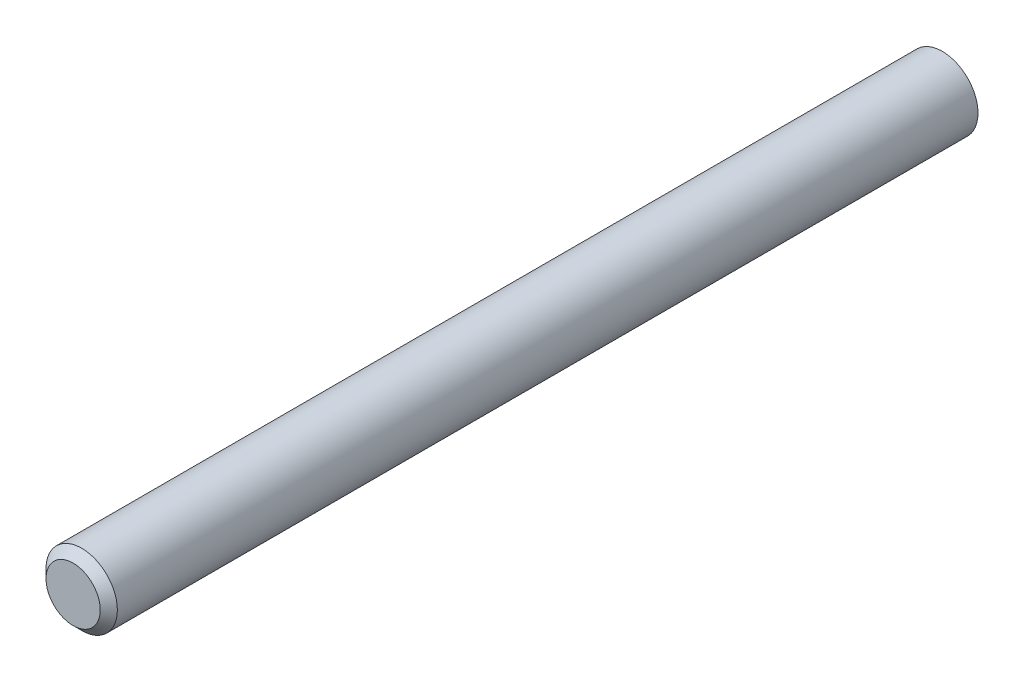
SolidWorks part; units mm, degrees
ref_plane "Front Plane" through (0, 0, 0) normal (0, 0, 1) x (1, 0, 0)
ref_plane "Top Plane" through (0, 0, 0) normal (0, 1, 0) x (1, 0, 0)
ref_plane "Right Plane" through (0, 0, 0) normal (1, 0, 0) x (0, 0, -1)
sketch "Sketch1" plane through (0, 0, 0) normal (0, 0, 1) x (1, 0, 0)
  circle A1 centre (0, 0) radius 3.175
  circle A2 centre (0, 0) radius 3.175
  dimension "D1" = 0
extrude "Boss-Extrude3" add sketch "Sketch1" along normal blind 77.343
chamfer "Chamfer1" distance 0.762 angle 45 1 edges at (3.175, 0, 77.343)
